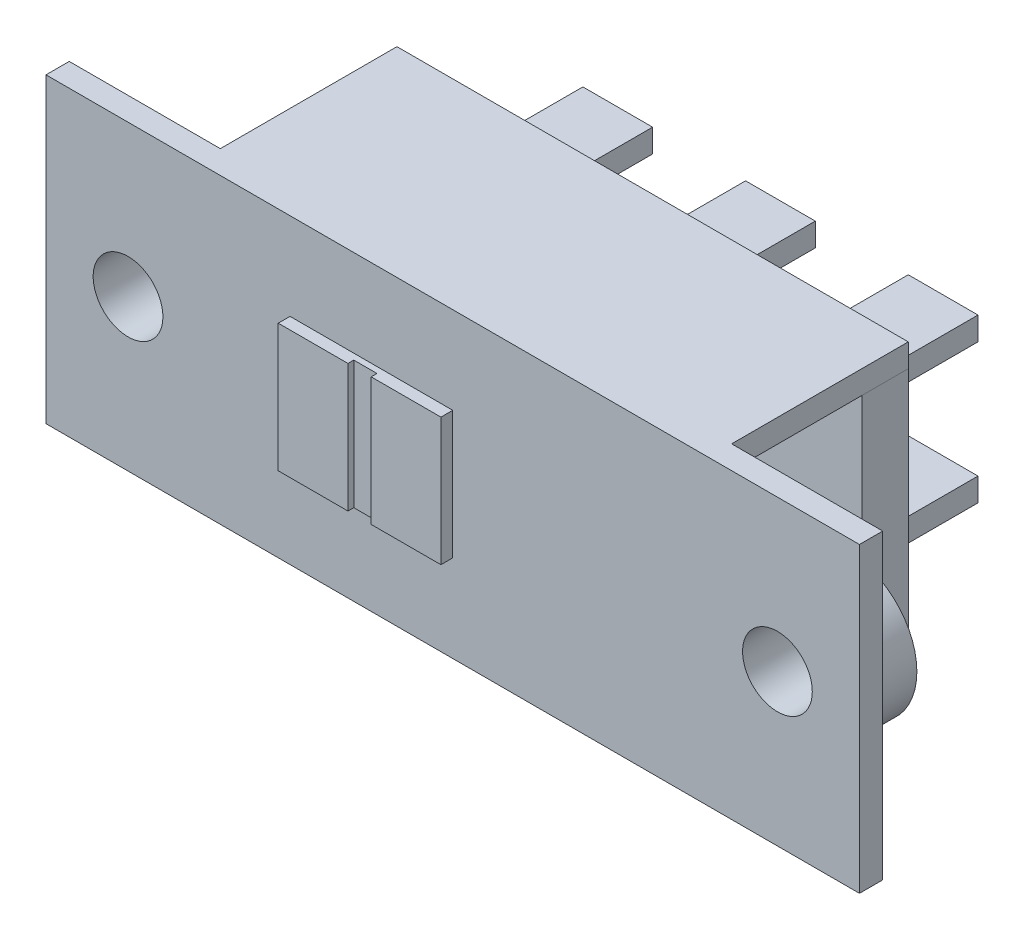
SolidWorks part; units mm, degrees
ref_plane "Спереди" through (0, 0, 0) normal (0, 0, 1) x (1, 0, 0)
ref_plane "Сверху" through (0, 0, 0) normal (0, 1, 0) x (1, 0, 0)
ref_plane "Справа" through (0, 0, 0) normal (1, 0, 0) x (0, 0, -1)
sketch "Эскиз1" plane through (0, 0, 0) normal (0, 0, 1) x (1, 0, 0)
  line L1 (-17.5, 6.5) -> (17.5, 6.5)
  line L2 (-17.5, 6.5) -> (-17.5, -6.5)
  line L3 (-17.5, -6.5) -> (17.5, -6.5)
  line L4 (17.5, 6.5) -> (17.5, -6.5)
extrude "Бобышка-Вытянуть1" add sketch "Эскиз1" along normal blind 1
sketch "Эскиз2" plane through (0, 0, 0) normal (0, 0, -1) x (-1, 0, 0)
  circle A0 centre (13.97, 0) radius 3
  circle A1 centre (-13.97, 0) radius 3
extrude "Бобышка-Вытянуть2" add sketch "Эскиз2" along normal blind 2
sketch "Эскиз3" plane through (0, 0, 0) normal (0, 0, -1) x (-1, 0, 0)
  line L1 (17.5, -6.5) -> (-17.5, -6.5) construction
  line L2 (11, -6.5) -> (-11, -6.5)
  line L3 (11, -6.5) -> (11, -5.5)
  line L4 (11, -5.5) -> (-11, -5.5)
  line L5 (-11, -6.5) -> (-11, -5.5)
  line L6 (-17.5, 6.5) -> (17.5, 6.5) construction
  line L7 (11, 6.5) -> (-11, 6.5)
  line L8 (11, 6.5) -> (11, 5.5)
  line L9 (11, 5.5) -> (-11, 5.5)
  line L10 (-11, 6.5) -> (-11, 5.5)
extrude "Бобышка-Вытянуть3" add sketch "Эскиз3" along normal blind 7.6
sketch "Эскиз4" plane through (0, 0, 1) normal (0, 0, 1) x (1, 0, 0)
  circle A0 centre (-13.97, 0) radius 1.5
  circle A1 centre (13.97, 0) radius 1.5
extrude "Вырез-Вытянуть1" cut sketch "Эскиз4" against normal up to surface (3 mm away)
sketch "Эскиз5" plane through (0, 0, -7.6) normal (0, 0, -1) x (-1, 0, 0)
  line L1 (11, 5.5) -> (-11, 5.5)
  line L2 (11, 5.5) -> (11, -5.5)
  line L3 (11, -5.5) -> (-11, -5.5)
  line L4 (-11, 5.5) -> (-11, -5.5)
extrude "Бобышка-Вытянуть4" add sketch "Эскиз5" against normal blind 2 separate body
sketch "Эскиз6" plane through (0, 0, -7.6) normal (0, 0, -1) x (-1, 0, 0)
  line L1 (1.5, -3.5) -> (-1.5, -3.5)
  line L2 (1.5, -3.5) -> (1.5, -2.5)
  line L3 (1.5, -2.5) -> (-1.5, -2.5)
  line L4 (-1.5, -3.5) -> (-1.5, -2.5)
  line L5 (8.5, -3.5) -> (5.5, -3.5)
  line L6 (8.5, -3.5) -> (8.5, -2.5)
  line L7 (8.5, -2.5) -> (5.5, -2.5)
  line L8 (5.5, -3.5) -> (5.5, -2.5)
  line L9 (-5.5, -3.5) -> (-8.5, -3.5)
  line L10 (-5.5, -3.5) -> (-5.5, -2.5)
  line L11 (-5.5, -2.5) -> (-8.5, -2.5)
  line L12 (-8.5, -3.5) -> (-8.5, -2.5)
  line L13 (8.5, 2.5) -> (5.5, 2.5)
  line L14 (8.5, 2.5) -> (8.5, 3.5)
  line L15 (8.5, 3.5) -> (5.5, 3.5)
  line L16 (5.5, 2.5) -> (5.5, 3.5)
  line L17 (1.5, 2.5) -> (-1.5, 2.5)
  line L18 (1.5, 2.5) -> (1.5, 3.5)
  line L19 (1.5, 3.5) -> (-1.5, 3.5)
  line L20 (-1.5, 2.5) -> (-1.5, 3.5)
  line L21 (-5.5, 2.5) -> (-8.5, 2.5)
  line L22 (-5.5, 2.5) -> (-5.5, 3.5)
  line L23 (-5.5, 3.5) -> (-8.5, 3.5)
  line L24 (-8.5, 2.5) -> (-8.5, 3.5)
extrude "Бобышка-Вытянуть5" add sketch "Эскиз6" along normal blind 5.5 separate body
sketch "Эскиз7" plane through (0, 0, 1) normal (0, 0, 1) x (1, 0, 0)
  line L1 (-7, 2.75) -> (0, 2.75)
  line L2 (-7, 2.75) -> (-7, -2.75)
  line L3 (-7, -2.75) -> (0, -2.75)
  line L4 (0, 2.75) -> (0, -2.75)
extrude "Бобышка-Вытянуть6" add sketch "Эскиз7" along normal blind 0.508 separate body
sketch "Sketch1" plane through (0, 0, 1.508) normal (0, 0, 1) x (1, 0, 0)
  line L0 (0, 2.75) -> (-7, 2.75) construction
  line L1 (-4, -2.75) -> (-3, -2.75)
  line L2 (-4, 2.75) -> (-4, -2.75)
  line L3 (-7, -2.75) -> (0, -2.75) construction
  line L4 (-3, -2.75) -> (-3, 2.75)
  line L6 (-3, 2.75) -> (-4, 2.75)
extrude "Cut-Extrude1" cut sketch "Sketch1" against normal blind 0.25
